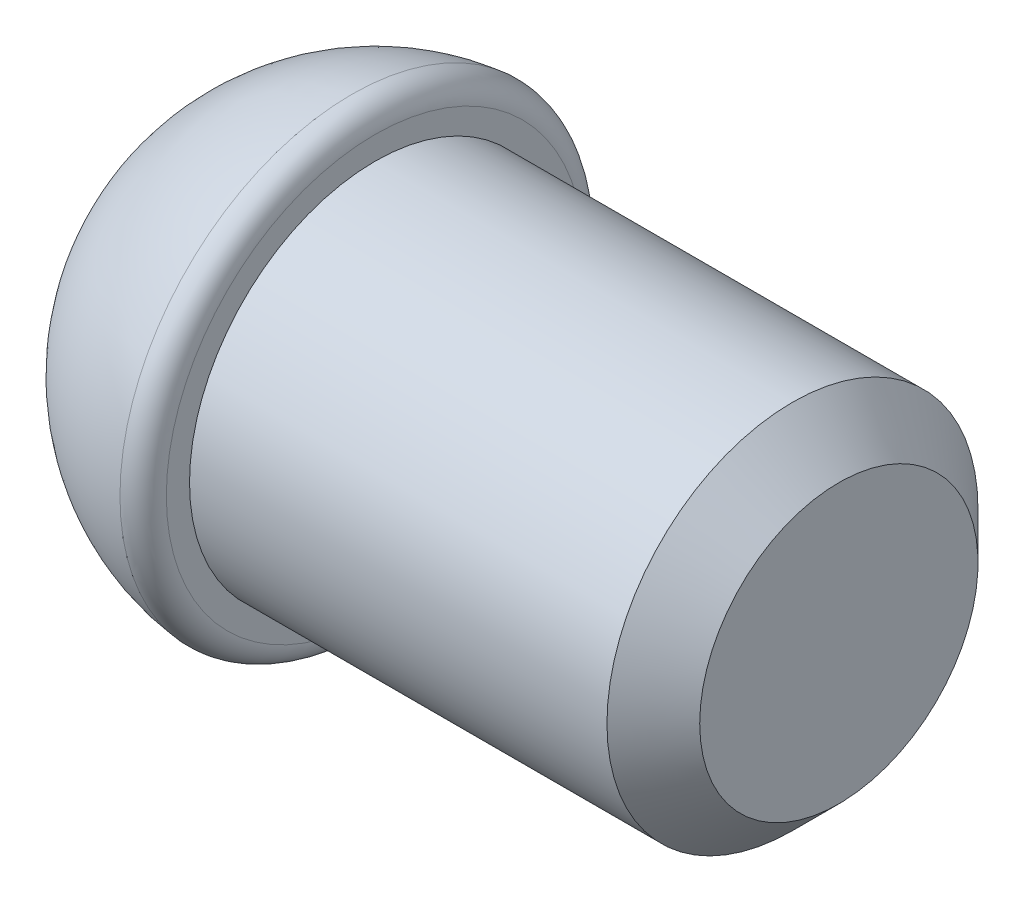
SolidWorks part; units mm, degrees
ref_plane "Face" through (0, 0, 0) normal (0, 0, 1) x (1, 0, 0)
ref_plane "Dessus" through (0, 0, 0) normal (0, 1, 0) x (1, 0, 0)
ref_plane "Droite" through (0, 0, 0) normal (1, 0, 0) x (0, 0, -1)
sketch "Esquisse1" plane through (0, 0, 0) normal (0, 0, 1) x (1, 0, 0)
  line L0 (0, 0) -> (3, 0)
  line L1 (3, 0) -> (3, 0.8)
  line L2 (3, 0.8) -> (1, 0.8)
  line L3 (1, 0.8) -> (1, 1)
  line L4 (1, 1) -> (0, 1)
  line L5 (0, 1) -> (0, 0)
  dimension "D1" = 1
  dimension "D2" = 1
  dimension "D3" = 0.8
  dimension "D4" = 3
revolve "Révolution1" add sketch "Esquisse1" angle 360 about L0
fillet "Congé1" radius 0.1 1 edges at (1, 0, 1)
chamfer "Chanfrein1" distance 0.2 angle 45 1 edges at (3, 0, 0.8)
fillet "Congé2" radius 1 1 edges at (0, 0, 1)
